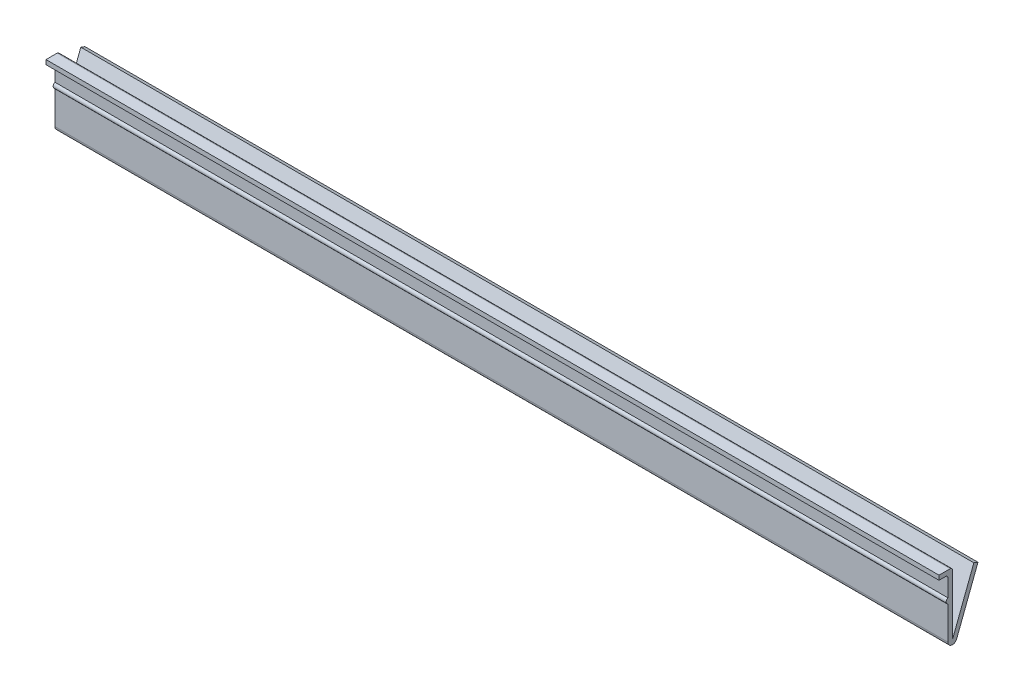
SolidWorks part; units mm, degrees
ref_plane "Front Plane" through (0, 0, 0) normal (0, 0, 1) x (1, 0, 0)
ref_plane "Top Plane" through (0, 0, 0) normal (0, 1, 0) x (1, 0, 0)
ref_plane "Right Plane" through (0, 0, 0) normal (1, 0, 0) x (0, 0, -1)
sketch3d "3DSketch1"
  line L0 (0, 0, 0) -> (200, 0, 0)
  dimension "D1" = 200
other "Asennuslistat 1.6002 ASENNUSLISTA 45(1)"
ref_plane "Plane1" through (0, 0, 0) normal (1, 0, 0) x (0, 0, -1)
sketch "Sketch1" plane through (0, 0, 0) normal (1, 0, 0) x (0, 0, -1)
  line L0 (-5.0312, 10.1176) -> (-2.5312, 10.1176)
  line L1 (-2.0312, 9.6176) -> (-2.0312, -3.8761)
  line L2 (-2.0188, -3.8784) -> (2.7623, 8.6176)
  line L3 (-5.0312, 9.1176) -> (-3.5312, 9.1176)
  line L4 (-3.0312, 8.6176) -> (-3.0312, 4.7174)
  line L5 (-1.0848, -4.2357) -> (3.6963, 8.2603)
  line L6 (2.7623, 8.6176) -> (3.6963, 8.2603)
  line L7 (-5.0312, 10.1176) -> (-5.0312, 9.1176)
  line L8 (-5.0312, 9.1176) -> (-3.0312, 9.1176) construction
  line L9 (-3.0312, 9.1176) -> (-3.0312, -3.8761) construction
  line L10 (-5.0312, 10.1176) -> (-2.0312, 10.1176) construction
  line L11 (-2.0312, 10.1176) -> (-2.0312, -3.8761) construction
  line L12 (-3.0312, 3.5179) -> (-3.0312, -3.8761)
  arc A0 (-2.0312, -3.8761) -> (-2.0188, -3.8784) centre (-2.0248, -3.8761) ccw
  arc A1 (-3.0312, -3.8761) -> (-1.0848, -4.2357) centre (-2.0248, -3.8761) ccw
  arc A2 (-3.5312, 9.1176) -> (-3.0312, 8.6176) centre (-3.5312, 8.6176) cw
  arc A3 (-2.5312, 10.1176) -> (-2.0312, 9.6176) centre (-2.5312, 9.6176) cw
  arc A4 (-3.0312, 4.7174) -> (-3.0312, 3.5179) centre (-2.7805, 4.1176) ccw
  point P5 (-2.0259, -3.8824)
  point P13 (0, 0)
  point P20 (-2.0312, 10.1176)
  dimension "D1" = 3
  dimension "D3" = 1
  dimension "D4" = 0.5
  dimension "D5" = 1.3
  dimension "D2" = 14
  dimension "D6" = 6
  dimension "D7" = 0.7494
